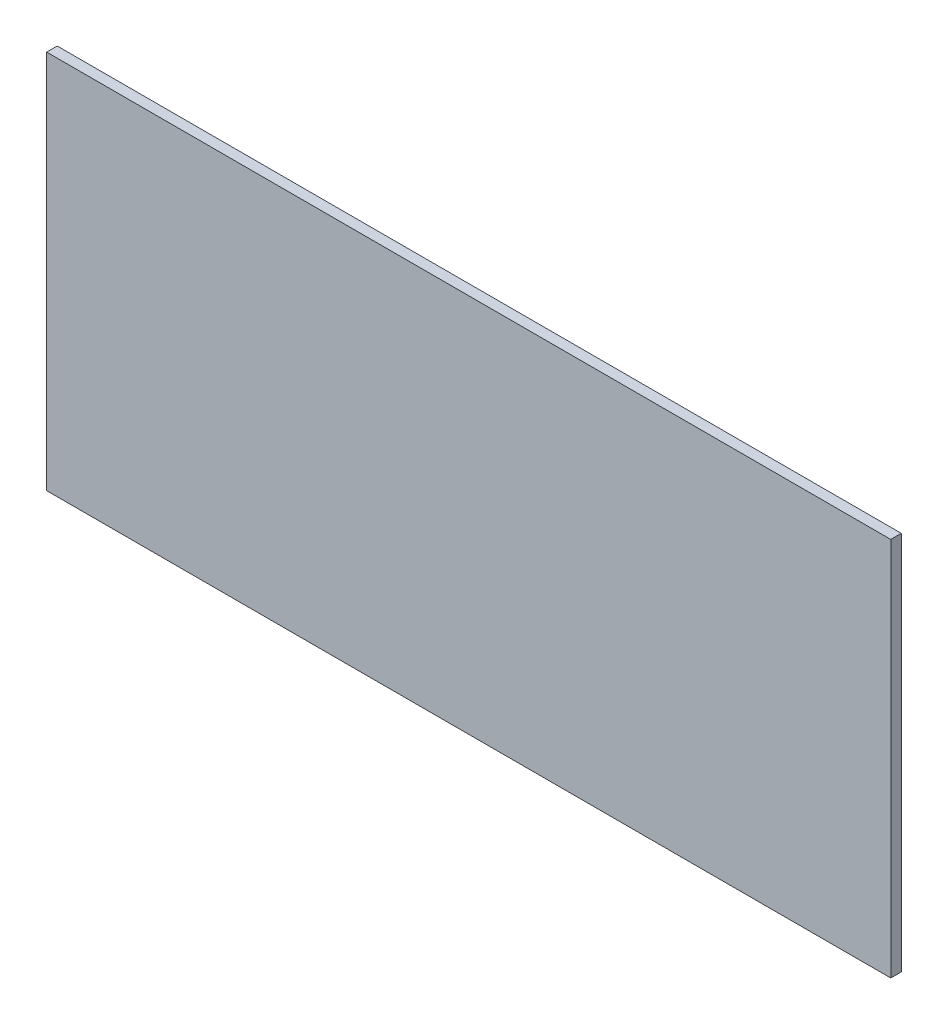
SolidWorks part; units mm, degrees
ref_plane "Front Plane" through (0, 0, 0) normal (0, 0, 1) x (1, 0, 0)
ref_plane "Top Plane" through (0, 0, 0) normal (0, 1, 0) x (1, 0, 0)
ref_plane "Right Plane" through (0, 0, 0) normal (1, 0, 0) x (0, 0, -1)
sketch "Sketch1" plane through (0, 0, 0) normal (0, 0, 1) x (1, 0, 0)
  line L1 (0, 0) -> (254, 0)
  line L2 (0, 0) -> (0, 114.3)
  line L3 (0, 114.3) -> (254, 114.3)
  line L4 (254, 0) -> (254, 114.3)
  dimension "D1" = 114.3
  dimension "D2" = 254
extrude "Boss-Extrude1" add sketch "Sketch1" along normal blind 3.175
sketch "Sketch2" plane through (0, 0, 3.175) normal (0, 0, 1) x (1, 0, 0)
  line L0 (22.225, 114.3) -> (22.225, 0) construction
  line L1 (254, 114.3) -> (0, 114.3) construction
  line L2 (0, 0) -> (254, 0) construction
  line L3 (231.775, 114.3) -> (231.775, 0) construction
  line L4 (0, 114.3) -> (0, 0) construction
  line L5 (254, 0) -> (254, 114.3) construction
  dimension "D1" = 22.225
  dimension "D2" = 22.225
